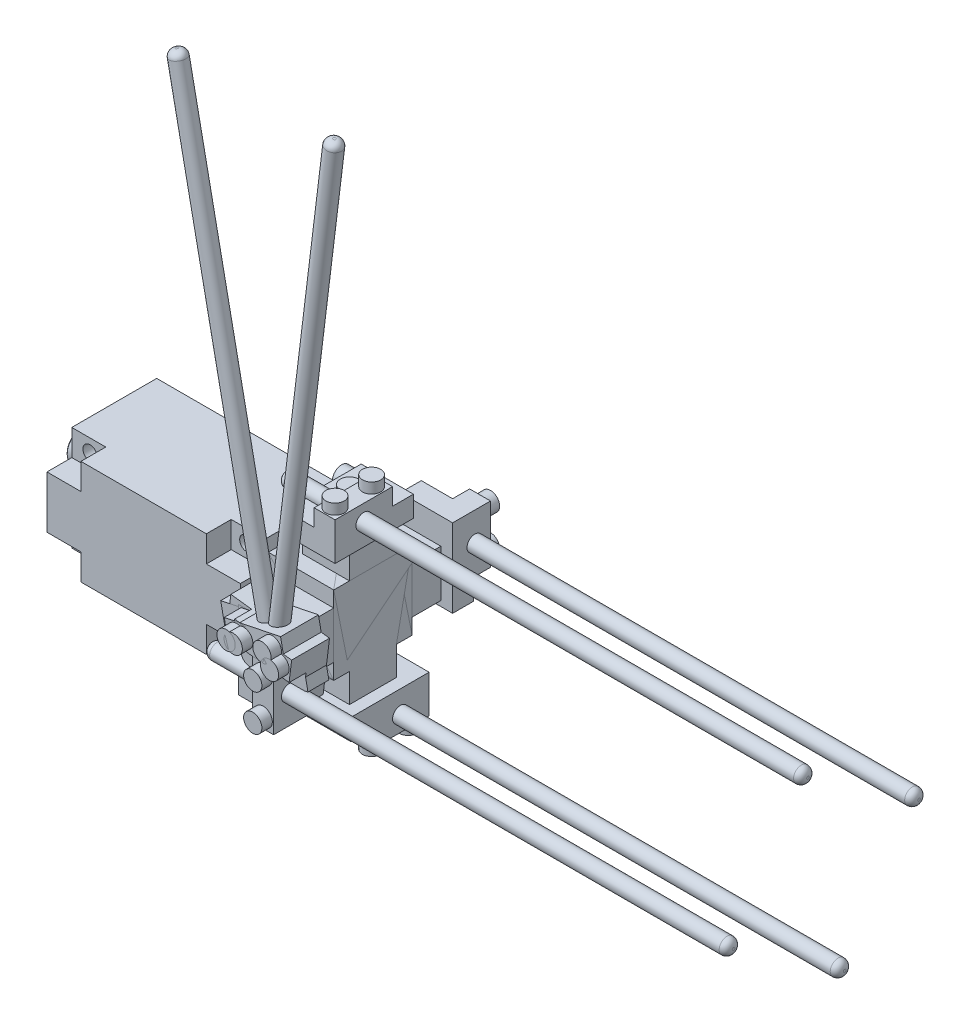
SolidWorks part; units mm, degrees
ref_plane "Ebene vorne" through (0, 0, 0) normal (0, 0, 1) x (1, 0, 0)
ref_plane "Ebene oben" through (0, 0, 0) normal (0, 1, 0) x (1, 0, 0)
ref_plane "Ebene rechts" through (0, 0, 0) normal (1, 0, 0) x (0, 0, -1)
imported_body "93027.sldasm-Part-1-1-solid1"
imported_body "93027.sldasm-Part-1-2-solid1"
imported_body "93027.sldasm-Part-1-3-solid1"
imported_body "93027.sldasm-Part-1-4-solid1"
imported_body "93027.sldasm-Part-2-1-solid1"
imported_body "93027.sldasm-Part-2-2-solid1"
imported_body "93027.sldasm-Part-2-3-solid1"
imported_body "93027.sldasm-Part-2-4-solid1"
imported_body "93027.sldasm-Part-3-1-solid1"
imported_body "93027.sldasm-Part-3-2-solid1"
imported_body "93027.sldasm-Part-3-3-solid1"
imported_body "93027.sldasm-Part-3-4-solid1"
imported_body "93027.sldasm-Part-4-1-solid1"
imported_body "93027_0006.sldasm-Part-1-1-solid1"
imported_body "93027_0006.sldasm-Part-1-2-solid1"
imported_body "93027_0006.sldasm-Part-2-1-solid1"
imported_body "93027_0006.sldasm-Part-2-2-solid1"
move or copy body "Körper-Verschieben/Kopieren2" bodies to move or copy 126 127 128 129 placed by mates yes
other "Winkel1" parameters "D1"=7
